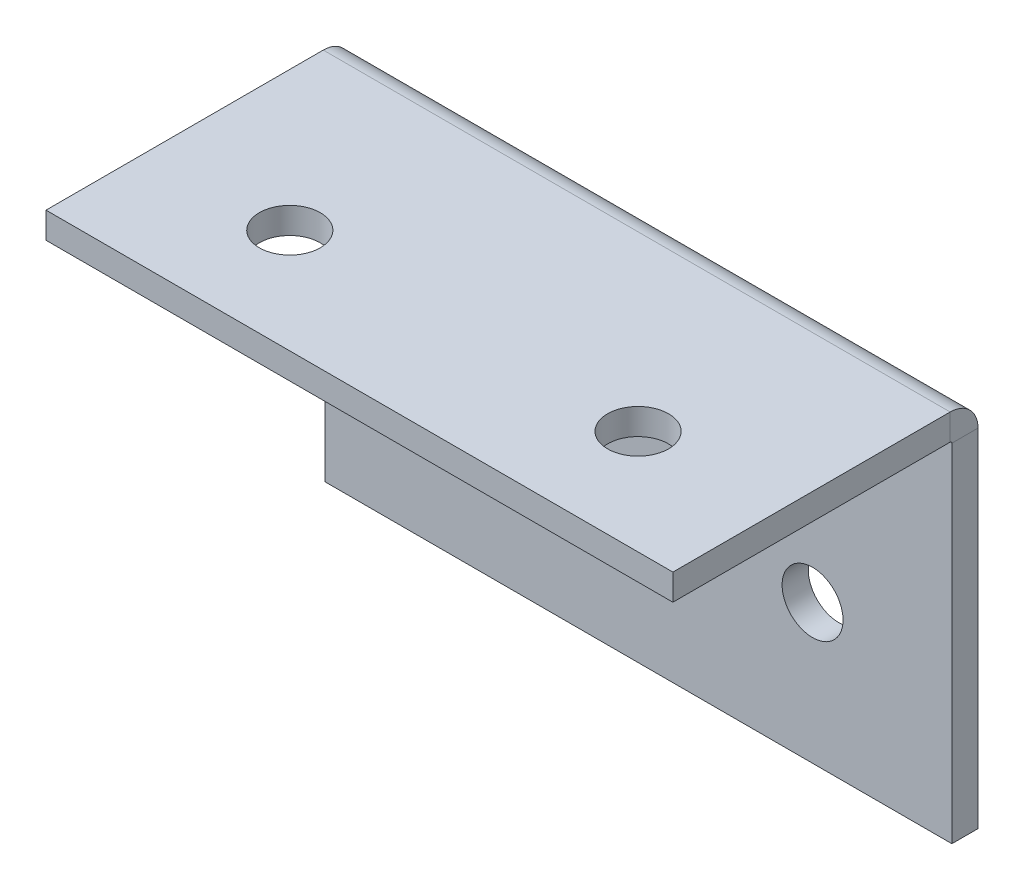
SolidWorks part; units mm, degrees
ref_plane "Front Plane" through (0, 0, 0) normal (0, 0, 1) x (1, 0, 0)
ref_plane "Top Plane" through (0, 0, 0) normal (0, 1, 0) x (1, 0, 0)
ref_plane "Right Plane" through (0, 0, 0) normal (1, 0, 0) x (0, 0, -1)
sketch "Sketch1" plane through (0, 0, 0) normal (0, 0, 1) x (1, 0, 0)
  line L0 (0, 20) -> (36, 20) construction
  line L1 (0, 0) -> (36, 0)
  line L2 (0, 0) -> (0, 36)
  line L3 (0, 36) -> (36, 36)
  line L4 (36, 0) -> (36, 36)
  line L5 (0, 30) -> (36, 30) construction
  line L6 (0, 8) -> (36, 8) construction
  line L7 (8, 30) -> (8, 8) construction
  line L8 (28, 30) -> (28, 8) construction
  circle A0 centre (8, 30) radius 1.75
  circle A1 centre (28, 30) radius 1.75
  circle A2 centre (28, 8) radius 1.75
  circle A3 centre (8, 8) radius 1.75
  dimension "D1" = 3.5
  dimension "D2" = 20
  dimension "D3" = 8
  dimension "D4" = 36
  dimension "D5" = 10
  dimension "D6" = 16
  dimension "D7" = 12
  dimension "D8" = 20
sheet metal parameters "Sheet-Metal1" thickness 1.5 parameters "D1"=1
base flange "Base-Flange1" sketch "Sketch1" thickness 1.5 reverse thickness direction no parameters "D1"=1
sketch "Sketch3" plane through (0, 0, 0) normal (0, 0, 1) x (1, 0, 0)
  line L0 (0, 20) -> (36, 20)
  line L1 (0, 0) -> (0, 36) construction
  line L2 (36, 0) -> (36, 36) construction
  line L3 (36, 36) -> (0, 36) construction
  dimension "D1" = 16
sketched bend "Sketched Bend1" parameters "D1"=0.1
bend "SketchBend1" bend radius 0.1 bend angle 90 parameters "D5"=1
flat pattern "Flat-Pattern1"
sketch "Bend-Lines1" plane through (0, 0, 0) normal (0, 1, 0) x (-1, 0, 0)
bend of the flat pattern "Flatten-<SketchBend1>1"
